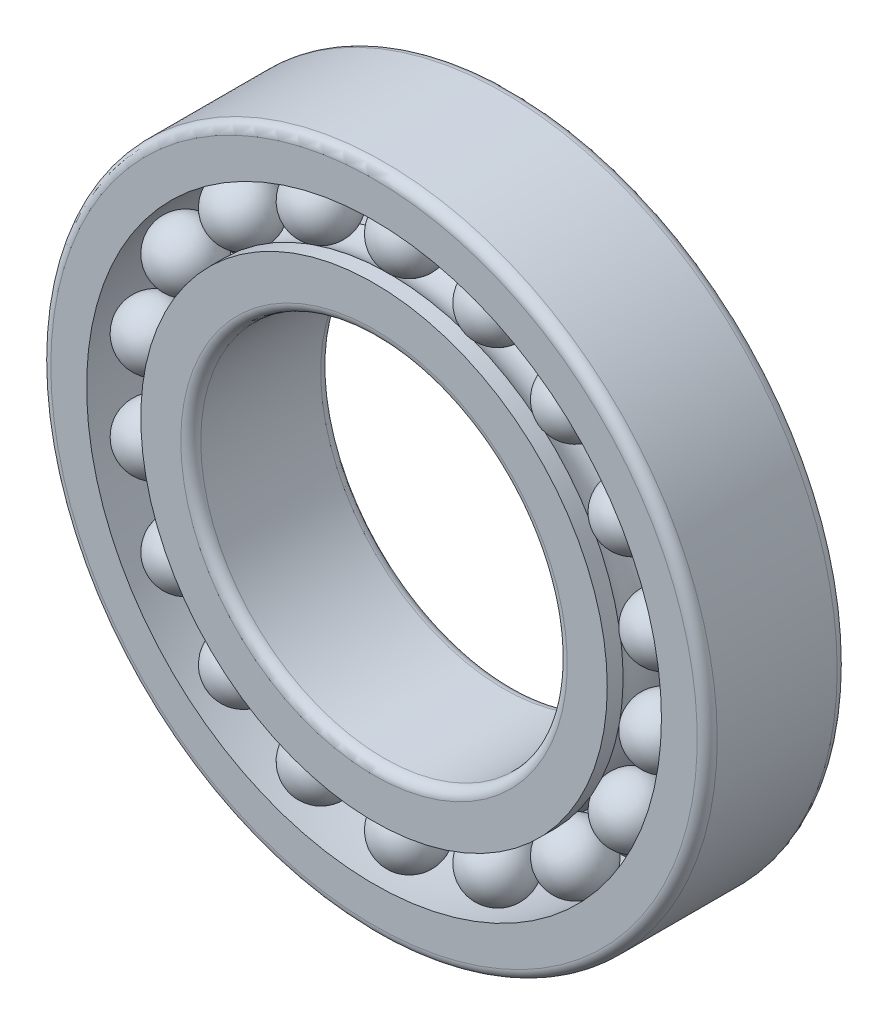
SolidWorks part; units mm, degrees
ref_plane "Front Plane" through (0, 0, 0) normal (0, 0, 1) x (1, 0, 0)
ref_plane "Top Plane" through (0, 0, 0) normal (0, 1, 0) x (1, 0, 0)
ref_plane "Right Plane" through (0, 0, 0) normal (1, 0, 0) x (0, 0, -1)
sketch "BaseSke" plane through (0, 0, 0) normal (1, 0, 0) x (0, 0, -1)
  line L0 (-47.2296, 0) -> (24.6132, 0) construction
  line L1 (-47.2296, 38.75) -> (24.6132, 38.75) construction
  line L2 (0, 129.5214) -> (0, -86.3012) construction
  line L3 (-5.2023, 43.5227) -> (-5.2023, 33.9773)
  line L4 (-10.5, 50) -> (10.5, 50) construction
  line L5 (-10.5, 27.5) -> (10.5, 27.5) construction
  line L6 (-10.5, 50) -> (-10.5, 27.5) construction
  line L7 (10.5, 50) -> (10.5, 27.5) construction
  line L8 (-9.975, 50) -> (-9.975, 27.5) construction
  arc A0 (-5.2023, 43.5227) -> (-5.2023, 33.9773) centre (-5.2023, 38.75) ccw
  dimension "D2" = 0.525
  dimension "Ball_diameter" = 9.5455
  dimension "D1" = 38.75
  dimension "Bearing_Thickness" = 21
  dimension "Bearing_Outside_Diameter" = 100
  dimension "Bearing_Inside_Diameter" = 55
revolve "Ball" add sketch "BaseSke" angle 360 about L3
sketch "OuterRaceSke" plane through (0, 0, 0) normal (1, 0, 0) x (0, 0, -1)
  line L0 (0, 0) -> (0, 87.5396) construction
  line L1 (-10.5, 50) -> (10.5, 50)
  line L2 (-10.5, 50) -> (-10.5, 43.1291)
  line L4 (10.5, 50) -> (10.5, 43.1291)
  line L5 (-50.3916, 0) -> (55.2197, 0) construction
  arc A0 (-10.5, 43.1291) -> (10.5, 43.1291) centre (0, -66.3686) cw
  arc A1 (-10.5, 43.1492) -> (10.5, 43.1492) centre (0, -66.3686) cw construction
  arc A3 (-5.2023, 43.5227) -> (-5.2023, 33.9773) centre (-5.2023, 38.75) ccw construction
  dimension "D1" = 110
  dimension "D2" = 0.02
revolve "OuterRace" add sketch "OuterRaceSke" angle 360 about L5
mirror "MirrorBall" about plane through (0, 0, 0) normal (0, 0, 1) of "Ball"
sketch "InnerRaceSke" plane through (0, 0, 0) normal (1, 0, 0) x (0, 0, -1)
  line L0 (-70.8626, 0) -> (113.5527, 0) construction
  line L1 (0, 58.441) -> (0, -70.8113) construction
  line L2 (-10.5, 27.5) -> (10.5, 27.5)
  line L3 (-10.5, 27.5) -> (-10.5, 35)
  line L4 (-10.5, 35) -> (-8.1384, 35)
  line L5 (10.5, 27.5) -> (10.5, 35)
  line L6 (0, 129.5214) -> (0, -86.3012) construction
  line L7 (-2.2661, 35) -> (2.2661, 35)
  line L8 (10.5, 35) -> (8.1384, 35)
  arc A0 (-8.1384, 35) -> (-2.2661, 35) centre (-5.2023, 38.75) ccw
  circle A1 centre (-5.2023, 38.75) radius 4.7727 construction
  arc A2 (8.1384, 35) -> (2.2661, 35) centre (5.2023, 38.75) cw
  point P17 (0, 27.5)
  point P23 (0, 35)
  dimension "D2" = 9.5255
  dimension "D1" = 70
revolve "InnerRace" add sketch "InnerRaceSke" angle 360 about L0
fillet "Fillet1" radius 1.5 4 edges at (27.5, 0, -10.5) (27.5, 0, 10.5) (50, 0, -10.5) (50, 0, 10.5)
pattern_circular "CirPatternBall" count 18 over 360 about axis through (0, 0, 0) along (0, 0, 1) of "Ball", "MirrorBall"
sketch "TaperSke" plane through (0, 0, 0) normal (1, 0, 0) x (0, 0, -1)
  line L0 (-10.5, 27.5) -> (10.5, 27.5)
  line L1 (10.5, 27.5) -> (10.5, 29.25)
  line L2 (10.5, 29.25) -> (-10.5, 27.5)
  line L7 (-41.2502, 0) -> (40.8606, 0) construction
  dimension "Taper" = 1.75
revolve "Taper" [suppressed] cut sketch "TaperSke" angle 360 about L7
fillet "Fillet2" [suppressed] radius 1.5
sketch "SimplifiedSke" plane through (0, 0, 0) normal (1, 0, 0) x (0, 0, -1)
  line L0 (37.5911, 0) -> (-37.5911, 0) construction
  line L1 (0, 0) -> (0, 72.9012) construction
  circle A0 centre (-5.2023, 38.75) radius 4.7727
  circle A1 centre (-5.2023, 38.75) radius 4.7727 construction
  circle A2 centre (5.2023, 38.75) radius 4.7727
revolve "Simplified" [suppressed] add sketch "SimplifiedSke" angle 360 about L0
equation "\"D1@BaseSke\" =  (\"Bearing_Outside_Diameter@BaseSke\"  +  \"Bearing_Inside_Diameter@BaseSke\"  )  / 4"
equation "\"Ball_diameter@BaseSke\" = \"Bearing_Thickness@BaseSke\" / 2.2"
equation "\"D1@InnerRaceSke\" = \"Bearing_Inside_Diameter@BaseSke\" +  ( \"Bearing_Outside_Diameter@BaseSke\" - \"Bearing_Inside_Diameter@BaseSke\" )  / 3"
equation "\"D1@CirPatternBall\" = int( \"D1@BaseSke\"* pi  * 2 / \"Ball_diameter@BaseSke\" /1.4)"
equation "\"Taper@TaperSke\" = \"Bearing_Thickness@BaseSke\"/12"
equation "\"D1@Fillet2\" = \"Fillet_radius@Fillet1\""
equation "\"D2@InnerRaceSke\" = \"Ball_diameter@BaseSke\"-0.02"
equation "\"D1@OuterRaceSke\" = \"Bearing_Inside_Diameter@BaseSke\"*2"
equation "\"D2@BaseSke\" = \"Bearing_Thickness@BaseSke\"/40"
